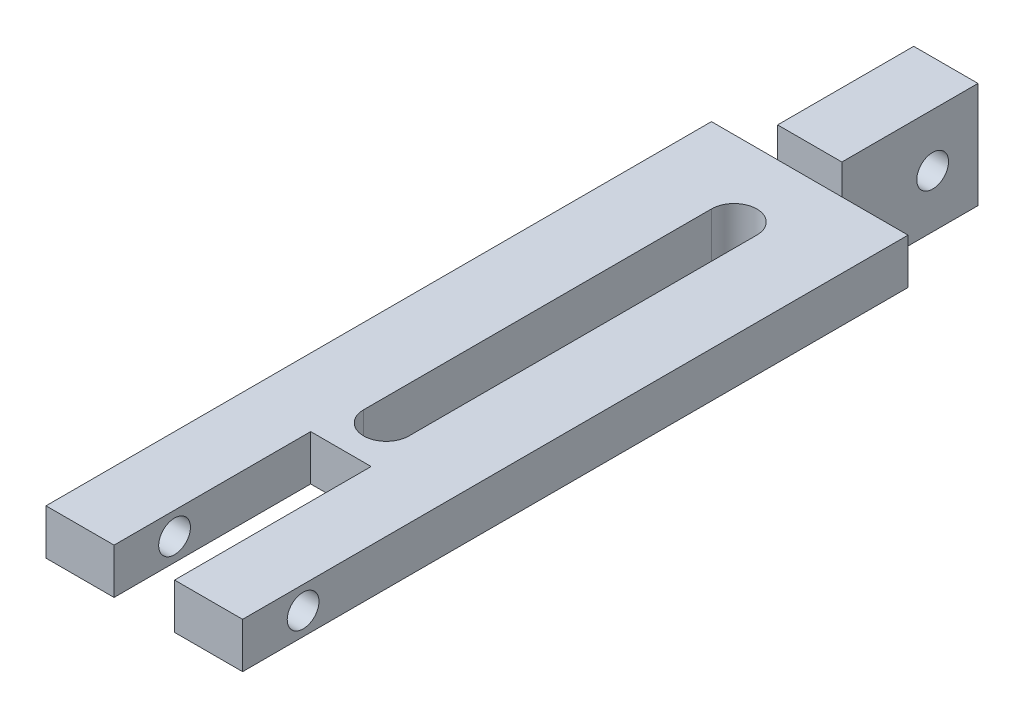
SolidWorks part; units mm, degrees
ref_plane "前视基准面" through (0, 0, 0) normal (0, 0, 1) x (1, 0, 0)
ref_plane "上视基准面" through (0, 0, 0) normal (0, 1, 0) x (1, 0, 0)
ref_plane "右视基准面" through (0, 0, 0) normal (1, 0, 0) x (0, 0, -1)
other "Configuration Table"
sketch "草图1" plane through (0, 0, 0) normal (0, 1, 0) x (1, 0, 0)
  line L0 (-4.25, 6) -> (4.25, 6)
  line L1 (4.25, 6) -> (4.25, -12)
  line L2 (4.25, -12) -> (13, -12)
  line L3 (13, -12) -> (13, -74)
  line L4 (13, -74) -> (13, -100)
  line L5 (13, -100) -> (4, -100)
  line L6 (4, -100) -> (4, -74)
  line L7 (4, -74) -> (-4, -74)
  line L8 (-4, -74) -> (-4, -100)
  line L9 (-4, -100) -> (-13, -100)
  line L10 (-13, -100) -> (-13, -74)
  line L11 (-13, -74) -> (-13, -12)
  line L12 (-13, -12) -> (-4.25, -12)
  line L13 (-4.25, -12) -> (-4.25, 6)
extrude "01_ARM_BODY" add sketch "草图1" against normal mid plane 6
sketch "草图2" plane through (0, 0, 0) normal (0, 1, 0) x (1, 0, 0)
  line L1 (-4.25, -12) -> (4.25, -12)
  line L2 (-4.25, -12) -> (-4.25, 6)
  line L3 (-4.25, 6) -> (4.25, 6)
  line L4 (4.25, -12) -> (4.25, 6)
extrude "02_NECK_BLOCK" add sketch "草图2" against normal mid plane 14
sketch "草图3" plane through (0, 0, 0) normal (0, 1, 0) x (1, 0, 0)
  line L0 (0, -22) -> (0, -68) construction
  line L1 (3, -22) -> (3, -68)
  line L2 (-3, -22) -> (-3, -68)
  arc A0 (3, -22) -> (-3, -22) centre (0, -22) ccw
  arc A1 (-3, -68) -> (3, -68) centre (0, -68) ccw
  point P3 (0, -45)
  point P8 (0, 0)
extrude "03_SLOT_F" cut sketch "草图3" along normal through all
sketch "草图4" plane through (0, 0, 0) normal (0, 1, 0) x (1, 0, 0)
  line L0 (0, -22) -> (0, -68) construction
  line L1 (3, -22) -> (3, -68)
  line L2 (-3, -22) -> (-3, -68)
  arc A0 (3, -22) -> (-3, -22) centre (0, -22) ccw
  arc A1 (-3, -68) -> (3, -68) centre (0, -68) ccw
  point P3 (0, -45)
  point P8 (0, 0)
extrude "03_SLOT_B" cut sketch "草图4" against normal through all
sketch "草图5" plane through (0, 0, 0) normal (1, 0, 0) x (0, 0, -1)
  circle A0 centre (0, 0) radius 2.1
extrude "04_PINHOLE_BOT_R" cut sketch "草图5" along normal through all
sketch "草图6" plane through (0, 0, 0) normal (1, 0, 0) x (0, 0, -1)
  circle A0 centre (0, 0) radius 2.1
extrude "04_PINHOLE_BOT_L" cut sketch "草图6" against normal through all
sketch "草图7" plane through (0, 0, 0) normal (1, 0, 0) x (0, 0, -1)
  circle A0 centre (-92, 0) radius 2.1
extrude "04_PINHOLE_TOP_R" cut sketch "草图7" along normal through all
sketch "草图8" plane through (0, 0, 0) normal (1, 0, 0) x (0, 0, -1)
  circle A0 centre (-92, 0) radius 2.1
extrude "04_PINHOLE_TOP_L" cut sketch "草图8" against normal through all
